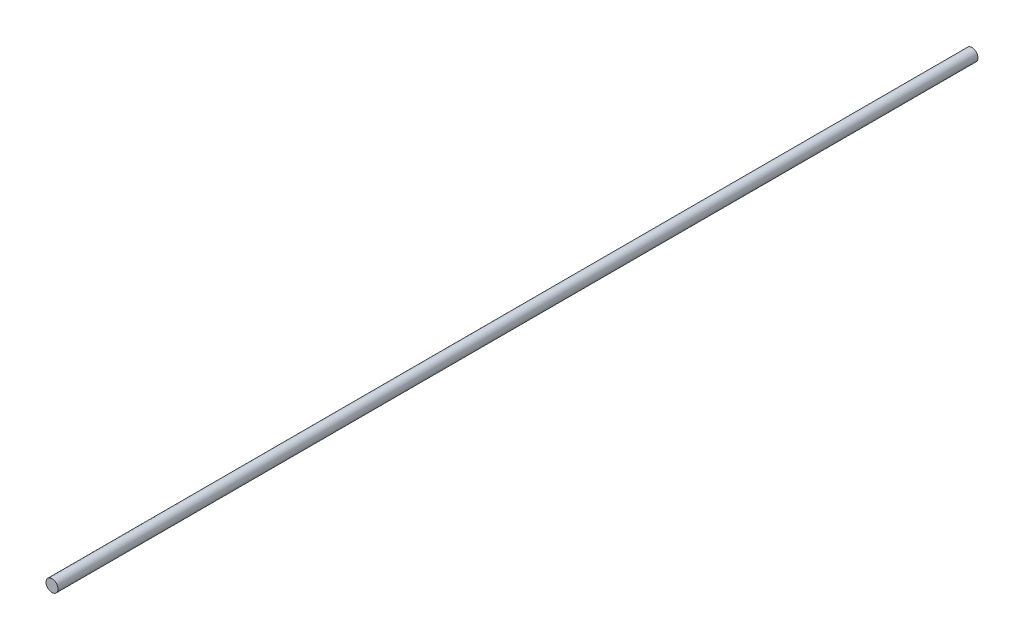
SolidWorks part; units mm, degrees
ref_plane "Front Plane" through (0, 0, 0) normal (0, 0, 1) x (1, 0, 0)
ref_plane "Top Plane" through (0, 0, 0) normal (0, 1, 0) x (1, 0, 0)
ref_plane "Right Plane" through (0, 0, 0) normal (1, 0, 0) x (0, 0, -1)
sketch "Sketch1" plane through (0, 0, 0) normal (0, 0, 1) x (1, 0, 0)
  circle A0 centre (0, 0) radius 30
  dimension "D1" = 60
extrude "Boss-Extrude1" add sketch "Sketch1" against normal blind 4600
